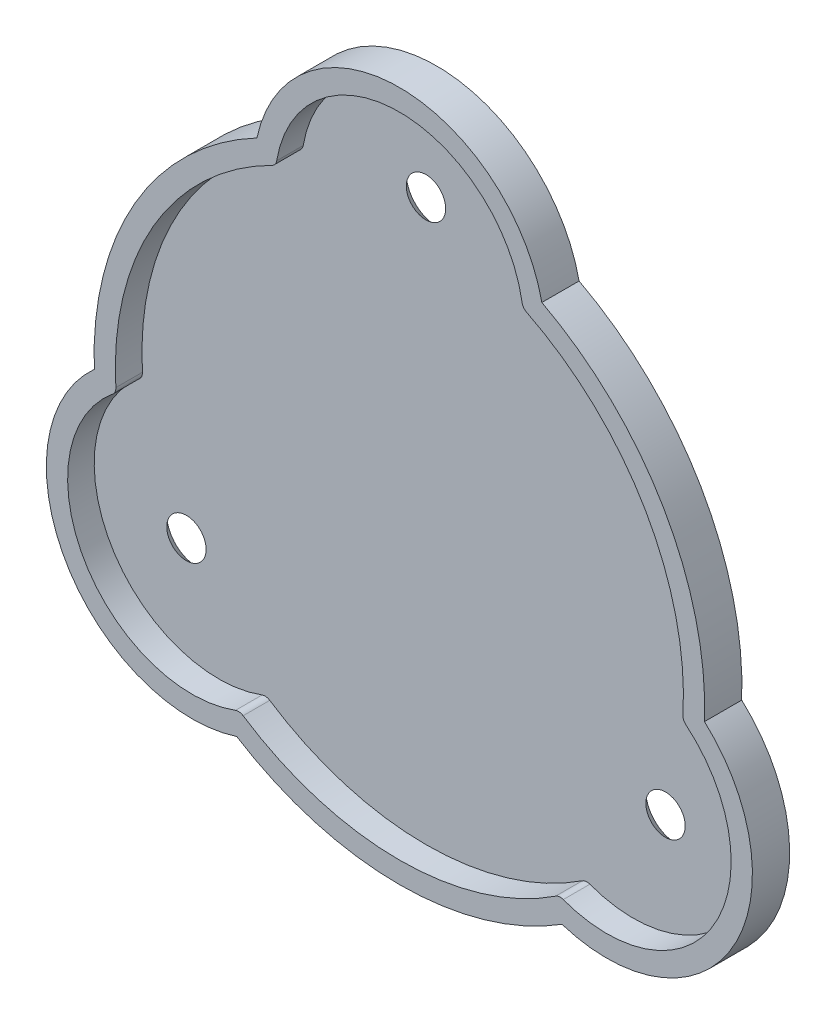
SolidWorks part; units mm, degrees
ref_plane "Спереди" through (0, 0, 0) normal (0, 0, 1) x (1, 0, 0)
ref_plane "Сверху" through (0, 0, 0) normal (0, 1, 0) x (1, 0, 0)
ref_plane "Справа" through (0, 0, 0) normal (1, 0, 0) x (0, 0, -1)
sketch "Эскиз1" plane through (0, 0, 1990) normal (0, 0, -1) x (-1, 0, 0)
  arc A78 (-1280.3833, 1127.8116) -> (-1280.3833, 1127.8116) centre (-1280.3833, 1127.8116) ccw
  arc A79 (-1253.597, 1127.8116) -> (-1280.3833, 1127.8116) centre (-1266.9902, 1124.9283) ccw
  arc A80 (-1253.597, 1127.8116) -> (-1253.597, 1127.8116) centre (-1253.597, 1127.8116) ccw
  arc A81 (-1238.311, 1101.3354) -> (-1253.597, 1127.8116) centre (-1266.9902, 1102.4283) ccw
  arc A82 (-1238.311, 1101.3354) -> (-1238.311, 1101.3354) centre (-1238.311, 1101.3354) ccw
  arc A83 (-1251.7041, 1078.1378) -> (-1238.311, 1101.3354) centre (-1247.5046, 1091.1783) ccw
  arc A84 (-1251.7041, 1078.1378) -> (-1251.7041, 1078.1378) centre (-1251.7041, 1078.1378) ccw
  arc A85 (-1282.2762, 1078.1378) -> (-1251.7041, 1078.1378) centre (-1266.9902, 1102.4283) ccw
  arc A86 (-1282.2762, 1078.1378) -> (-1282.2762, 1078.1378) centre (-1282.2762, 1078.1378) ccw
  arc A87 (-1295.6694, 1101.3354) -> (-1282.2762, 1078.1378) centre (-1286.4757, 1091.1783) ccw
  arc A88 (-1295.6694, 1101.3354) -> (-1295.6694, 1101.3354) centre (-1295.6694, 1101.3354) ccw
  arc A89 (-1280.3833, 1127.8116) -> (-1295.6694, 1101.3354) centre (-1266.9902, 1102.4283) ccw
  arc A90 (-1278.9568, 1126.2965) -> (-1278.5265, 1126.8783) centre (-1279.3153, 1127.0116) ccw
  arc A91 (-1278.9568, 1126.2965) -> (-1293.6439, 1100.8576) centre (-1266.9902, 1102.4283) ccw
  arc A92 (-1293.9327, 1100.1941) -> (-1293.6439, 1100.8576) centre (-1294.4426, 1100.8105) ccw
  arc A93 (-1293.9327, 1100.1941) -> (-1282.3963, 1080.2125) centre (-1286.4757, 1091.1783) ccw
  arc A94 (-1281.6773, 1080.1308) -> (-1282.3963, 1080.2125) centre (-1282.1174, 1079.4627) ccw
  arc A95 (-1281.6773, 1080.1308) -> (-1252.303, 1080.1308) centre (-1266.9902, 1102.4283) ccw
  arc A96 (-1251.584, 1080.2125) -> (-1252.303, 1080.1308) centre (-1251.863, 1079.4627) ccw
  arc A97 (-1251.584, 1080.2125) -> (-1240.0477, 1100.1941) centre (-1247.5046, 1091.1783) ccw
  arc A98 (-1240.3364, 1100.8576) -> (-1240.0477, 1100.1941) centre (-1239.5378, 1100.8105) ccw
  arc A99 (-1240.3364, 1100.8576) -> (-1255.0236, 1126.2965) centre (-1266.9902, 1102.4283) ccw
  arc A100 (-1255.4538, 1126.8783) -> (-1255.0236, 1126.2965) centre (-1254.665, 1127.0116) ccw
  arc A101 (-1255.4538, 1126.8783) -> (-1278.5265, 1126.8783) centre (-1266.9902, 1124.9283) ccw
  arc A102 (-1278.9568, 1126.2965) -> (-1278.5265, 1126.8783) centre (-1279.3153, 1127.0116) ccw
  arc A103 (-1278.9568, 1126.2965) -> (-1293.6439, 1100.8576) centre (-1266.9902, 1102.4283) ccw
  arc A104 (-1293.9327, 1100.1941) -> (-1293.6439, 1100.8576) centre (-1294.4426, 1100.8105) ccw
  arc A105 (-1293.9327, 1100.1941) -> (-1282.3963, 1080.2125) centre (-1286.4757, 1091.1783) ccw
  arc A106 (-1281.6773, 1080.1308) -> (-1282.3963, 1080.2125) centre (-1282.1174, 1079.4627) ccw
  arc A107 (-1281.6773, 1080.1308) -> (-1252.303, 1080.1308) centre (-1266.9902, 1102.4283) ccw
  arc A108 (-1251.584, 1080.2125) -> (-1252.303, 1080.1308) centre (-1251.863, 1079.4627) ccw
  arc A109 (-1251.584, 1080.2125) -> (-1240.0477, 1100.1941) centre (-1247.5046, 1091.1783) ccw
  arc A110 (-1240.3364, 1100.8576) -> (-1240.0477, 1100.1941) centre (-1239.5378, 1100.8105) ccw
  arc A111 (-1240.3364, 1100.8576) -> (-1255.0236, 1126.2965) centre (-1266.9902, 1102.4283) ccw
  arc A112 (-1255.4538, 1126.8783) -> (-1255.0236, 1126.2965) centre (-1254.665, 1127.0116) ccw
  arc A113 (-1255.4538, 1126.8783) -> (-1278.5265, 1126.8783) centre (-1266.9902, 1124.9283) ccw
  dimension "D1" = 0.2
  dimension "D2" = 2
extrude "Бобышка-Вытянуть1" add sketch "Эскиз1" against normal blind 2.5
sketch "Эскиз2" plane through (0, 0, 1990) normal (0, 0, -1) x (-1, 0, 0)
  arc A0 (-1295.6694, 1101.3354) -> (-1282.2762, 1078.1378) centre (-1286.4757, 1091.1783) ccw construction
  arc A1 (-1282.2762, 1078.1378) -> (-1251.7041, 1078.1378) centre (-1266.9902, 1102.4283) ccw construction
  arc A2 (-1251.7041, 1078.1378) -> (-1238.311, 1101.3354) centre (-1247.5046, 1091.1783) ccw construction
  arc A3 (-1238.311, 1101.3354) -> (-1253.597, 1127.8116) centre (-1266.9902, 1102.4283) ccw construction
  arc A4 (-1253.597, 1127.8116) -> (-1280.3833, 1127.8116) centre (-1266.9902, 1124.9283) ccw construction
  arc A5 (-1280.3833, 1127.8116) -> (-1295.6694, 1101.3354) centre (-1266.9902, 1102.4283) ccw construction
  arc A6 (-1295.6694, 1101.3354) -> (-1282.2762, 1078.1378) centre (-1286.4757, 1091.1783) ccw
  arc A7 (-1282.2762, 1078.1378) -> (-1251.7041, 1078.1378) centre (-1266.9902, 1102.4283) ccw
  arc A8 (-1251.7041, 1078.1378) -> (-1238.311, 1101.3354) centre (-1247.5046, 1091.1783) ccw
  arc A9 (-1238.311, 1101.3354) -> (-1253.597, 1127.8116) centre (-1266.9902, 1102.4283) ccw
  arc A10 (-1253.597, 1127.8116) -> (-1280.3833, 1127.8116) centre (-1266.9902, 1124.9283) ccw
  arc A11 (-1280.3833, 1127.8116) -> (-1295.6694, 1101.3354) centre (-1266.9902, 1102.4283) ccw
  circle A12 centre (-1266.9902, 1128.4283) radius 1.85
  circle A13 centre (-1244.4735, 1089.4283) radius 1.85
  circle A14 centre (-1289.5068, 1089.4283) radius 1.85
  dimension "D1" = 3.7
extrude "Бобышка-Вытянуть2" add sketch "Эскиз2" along normal blind 1
chamfer "Фаска1" distance 1 angle 45 3 edges at (1242.6235, 1089.4283, 1989) (1265.1402, 1128.4283, 1989) (1287.6568, 1089.4283, 1989)
sketch "Эскиз3" plane through (0, 0, 1989) normal (0, 0, -1) x (-1, 0, 0)
  circle A0 centre (-1266.9902, 1128.4283) radius 5.25
  circle A1 centre (-1244.4735, 1089.4283) radius 5.25
  circle A2 centre (-1289.5068, 1089.4283) radius 5.25
  circle A3 centre (-1266.9902, 1128.4283) radius 6.25
  circle A4 centre (-1244.4735, 1089.4283) radius 6.25
  circle A5 centre (-1289.5068, 1089.4283) radius 6.25
  dimension "D1" = 10.5
  dimension "D2" = 1
extrude "Бобышка-Вытянуть3" add sketch "Эскиз3" along normal blind 0.5
